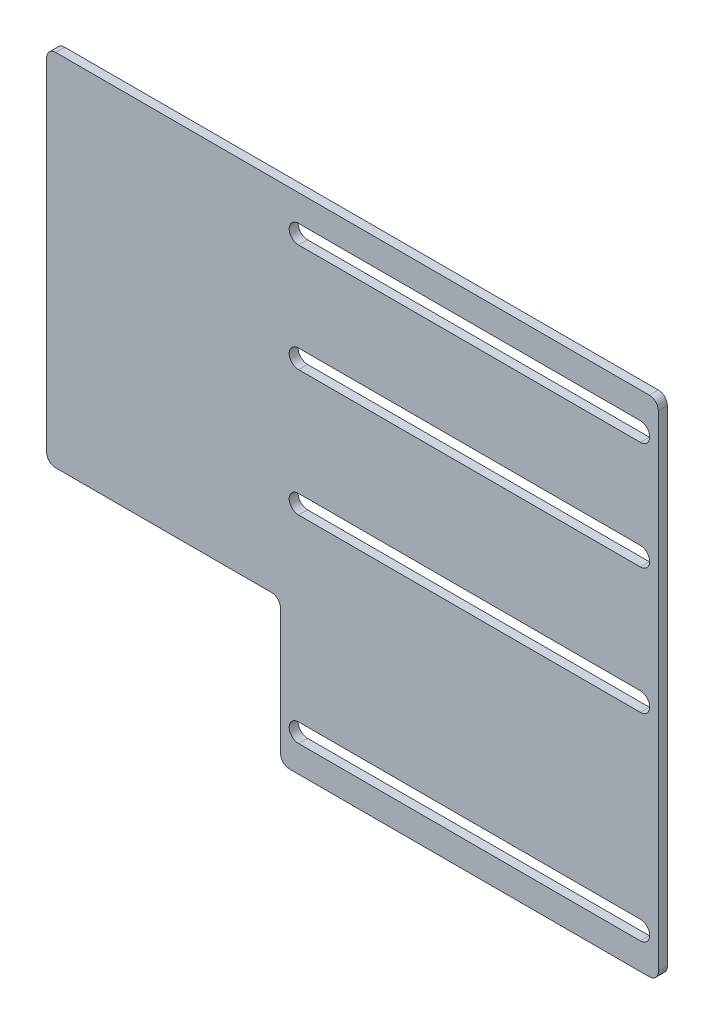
SolidWorks part; units mm, degrees
ref_plane "Front" through (0, 0, 0) normal (0, 0, 1) x (1, 0, 0)
ref_plane "Top" through (0, 0, 0) normal (0, 1, 0) x (1, 0, 0)
ref_plane "Right" through (0, 0, 0) normal (1, 0, 0) x (0, 0, -1)
sketch "Sketch1" plane through (0, 0, 0) normal (0, 0, 1) x (1, 0, 0)
  line L0 (0, 0) -> (0, 50.8)
  line L1 (0, 50.8) -> (-82.55, 50.8)
  line L2 (-82.55, 50.8) -> (-82.55, 177.8)
  line L3 (-82.55, 177.8) -> (133.35, 177.8)
  line L4 (133.35, 177.8) -> (133.35, 0)
  line L5 (133.35, 0) -> (0, 0)
  dimension "D1" = 50.8
  dimension "D2" = 177.8
  dimension "D3" = 215.9
  dimension "D4" = 82.55
extrude "Boss-Extrude1" add sketch "Sketch1" along normal blind 3.175
sketch "Sketch2" plane through (0, 0, 3.175) normal (0, 0, 1) x (1, 0, 0)
  line L0 (6.35, 165.1) -> (127, 165.1) construction
  line L1 (6.35, 168.402) -> (127, 168.402)
  line L2 (6.35, 161.798) -> (127, 161.798)
  line L3 (6.35, 127) -> (127, 127) construction
  line L4 (6.35, 130.302) -> (127, 130.302)
  line L5 (6.35, 123.698) -> (127, 123.698)
  line L6 (6.35, 82.55) -> (127, 82.55) construction
  line L7 (6.35, 85.852) -> (127, 85.852)
  line L8 (6.35, 79.248) -> (127, 79.248)
  line L9 (6.35, 12.7) -> (127, 12.7) construction
  line L10 (6.35, 16.002) -> (127, 16.002)
  line L11 (6.35, 9.398) -> (127, 9.398)
  line L12 (-82.55, 177.8) -> (-82.55, 50.8) construction
  line L13 (133.35, 177.8) -> (-82.55, 177.8) construction
  line L14 (0, 0) -> (133.35, 0) construction
  arc A0 (6.35, 168.402) -> (6.35, 161.798) centre (6.35, 165.1) ccw
  arc A1 (127, 161.798) -> (127, 168.402) centre (127, 165.1) ccw
  arc A2 (6.35, 130.302) -> (6.35, 123.698) centre (6.35, 127) ccw
  arc A3 (127, 123.698) -> (127, 130.302) centre (127, 127) ccw
  arc A4 (6.35, 85.852) -> (6.35, 79.248) centre (6.35, 82.55) ccw
  arc A5 (127, 79.248) -> (127, 85.852) centre (127, 82.55) ccw
  arc A6 (6.35, 16.002) -> (6.35, 9.398) centre (6.35, 12.7) ccw
  arc A7 (127, 9.398) -> (127, 16.002) centre (127, 12.7) ccw
  point P2 (66.675, 165.1)
  point P7 (66.675, 127)
  point P14 (66.675, 82.55)
  point P21 (66.675, 12.7)
  dimension "D3" = 3.302
  dimension "D1" = 88.9
  dimension "D2" = 209.55
  dimension "D4" = 12.7
  dimension "D5" = 82.55
  dimension "D6" = 12.7
  dimension "D7" = 114.3
extrude "Slotted Holes" cut sketch "Sketch2" against normal through all
fillet "Fillet1" radius 3.175 6 edges at (133.35, 0, 1.5875) (133.35, 177.8, 1.5875) (0, 50.8, 1.5875) (0, 0, 1.5875) (-82.55, 50.8, 1.5875) (-82.55, 177.8, 1.5875)
